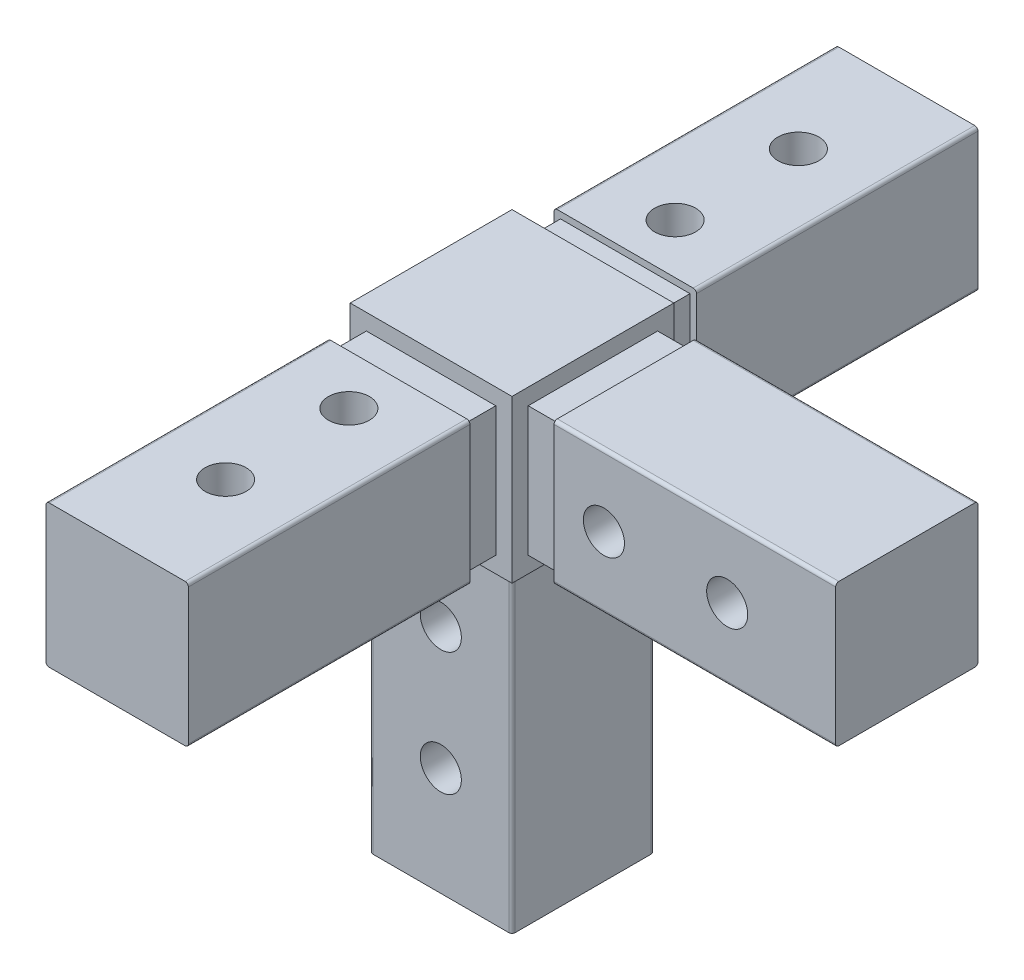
SolidWorks part; units mm, degrees
ref_plane "Front Plane" through (0, 0, 0) normal (0, 0, 1) x (1, 0, 0)
ref_plane "Top Plane" through (0, 0, 0) normal (0, 1, 0) x (1, 0, 0)
ref_plane "Right Plane" through (0, 0, 0) normal (1, 0, 0) x (0, 0, -1)
ref_plane "Plane1" through (0, -10, 0) normal (0, -1, 0) x (1, 0, 0)
sketch "Sketch1" plane through (0, -10, 0) normal (0, -1, 0) x (1, 0, 0)
  line L0 (-10, -17.5) -> (12.5, -17.5)
  line L1 (12.5, -17.5) -> (12.5, 12.5)
  line L2 (12.5, 12.5) -> (-10, 12.5)
  line L3 (-10, 12.5) -> (-10, -17.5)
extrude "Boss-Extrude1" add sketch "Sketch1" against normal blind 20
sketch "Sketch2" plane through (12.5, 0, 0) normal (1, 0, 0) x (0, 0, -1)
  line L0 (12.5, 10) -> (12.5, -10)
  line L1 (12.5, -10) -> (17.5, -10)
  line L2 (17.5, -10) -> (17.5, 10)
  line L3 (17.5, 10) -> (12.5, 10)
extrude "Cut-Extrude1" cut sketch "Sketch2" against normal blind 2.5
sketch "Sketch3" plane through (12.5, 0, 0) normal (1, 0, 0) x (0, 0, -1)
  line L0 (-10, 10) -> (10, 10)
  line L1 (10, 10) -> (10, -10)
  line L2 (10, -10) -> (-10, -10)
  line L3 (-10, -10) -> (-10, 10)
extrude "Boss-Extrude2" add sketch "Sketch3" along normal blind 5
sketch "Sketch4" plane through (17.5, 0, 0) normal (1, 0, 0) x (0, 0, -1)
  line L0 (11, -10) -> (-10, -10)
  line L1 (-10, -10) -> (-10, 11)
  line L2 (-10, 11) -> (11, 11)
  line L3 (11, 11) -> (11, -10)
extrude "Boss-Extrude3" add sketch "Sketch4" along normal blind 43.5
ref_plane "Plane2" through (0, 0, -17.5) normal (0, 0, 1) x (1, 0, 0)
sketch "Sketch5" plane through (0, 0, -17.5) normal (0, 0, 1) x (1, 0, 0)
  line L0 (-11, 11) -> (-11, -11)
  line L1 (-11, -11) -> (11, -11)
  line L2 (11, -11) -> (11, 11)
  line L3 (11, 11) -> (-11, 11)
extrude "Boss-Extrude4" add sketch "Sketch5" against normal blind 43.5
sketch "Sketch6" plane through (0, -10, 0) normal (0, -1, 0) x (1, 0, 0)
  line L0 (-10, 12.5) -> (12.5, 12.5)
  line L1 (12.5, 12.5) -> (12.5, -12.5)
  line L2 (12.5, -12.5) -> (-10, -12.5)
  line L3 (-10, -12.5) -> (-10, 12.5)
extrude "Boss-Extrude5" add sketch "Sketch6" along normal blind 2.5
sketch "Sketch7" plane through (-10, 0, 0) normal (-1, 0, 0) x (0, 0, 1)
  line L0 (12.5, 10) -> (12.5, -12.5)
  line L1 (12.5, -12.5) -> (-12.5, -12.5)
  line L2 (-12.5, -12.5) -> (-12.5, 10)
  line L3 (-12.5, 10) -> (12.5, 10)
extrude "Boss-Extrude6" add sketch "Sketch7" along normal blind 2.5
sketch "Sketch8" plane through (0, 10, 0) normal (0, 1, 0) x (-1, 0, 0)
  line L0 (12.5, -12.5) -> (-12.5, -12.5)
  line L1 (-12.5, -12.5) -> (-12.5, 12.5)
  line L2 (-12.5, 12.5) -> (12.5, 12.5)
  line L3 (12.5, 12.5) -> (12.5, -12.5)
extrude "Boss-Extrude7" add sketch "Sketch8" along normal blind 2.5
sketch "Sketch9" plane through (0, 0, 12.5) normal (0, 0, 1) x (1, 0, 0)
  line L0 (-10, 10) -> (10, 10)
  line L1 (10, 10) -> (10, -10)
  line L2 (10, -10) -> (-10, -10)
  line L3 (-10, -10) -> (-10, 10)
extrude "Boss-Extrude8" add sketch "Sketch9" along normal blind 48.5
sketch "Sketch10" plane through (0, 10, 0) normal (0, 1, 0) x (-1, 0, 0)
  line L0 (-10, 61) -> (10, 61)
  line L1 (10, 61) -> (10, 17.5)
  line L2 (10, 17.5) -> (-10, 17.5)
  line L3 (-10, 17.5) -> (-10, 61)
extrude "Boss-Extrude9" add sketch "Sketch10" along normal blind 1
sketch "Sketch11" plane through (10, 0, 0) normal (1, 0, 0) x (0, 0, -1)
  line L0 (-61, -10) -> (-61, 11)
  line L1 (-61, 11) -> (-17.5, 11)
  line L2 (-17.5, 11) -> (-17.5, -10)
  line L3 (-17.5, -10) -> (-61, -10)
extrude "Boss-Extrude10" add sketch "Sketch11" along normal blind 1
sketch "Sketch12" plane through (0, -10, 0) normal (0, -1, 0) x (1, 0, 0)
  line L0 (-10, 61) -> (11, 61)
  line L1 (11, 61) -> (11, 17.5)
  line L2 (11, 17.5) -> (-10, 17.5)
  line L3 (-10, 17.5) -> (-10, 61)
extrude "Boss-Extrude11" add sketch "Sketch12" along normal blind 1
sketch "Sketch13" plane through (-10, 0, 0) normal (-1, 0, 0) x (0, 0, 1)
  line L0 (61, 11) -> (61, -11)
  line L1 (61, -11) -> (17.5, -11)
  line L2 (17.5, -11) -> (17.5, 11)
  line L3 (17.5, 11) -> (61, 11)
extrude "Boss-Extrude12" add sketch "Sketch13" along normal blind 1
sketch "Sketch14" plane through (0, -10, 0) normal (0, -1, 0) x (1, 0, 0)
  line L0 (61, 10) -> (61, -11)
  line L1 (61, -11) -> (17.5, -11)
  line L2 (17.5, -11) -> (17.5, 10)
  line L3 (17.5, 10) -> (61, 10)
extrude "Boss-Extrude13" add sketch "Sketch14" along normal blind 1
sketch "Sketch15" plane through (0, 0, 10) normal (0, 0, 1) x (1, 0, 0)
  line L0 (61, 11) -> (61, -11)
  line L1 (61, -11) -> (17.5, -11)
  line L2 (17.5, -11) -> (17.5, 11)
  line L3 (17.5, 11) -> (61, 11)
extrude "Boss-Extrude14" add sketch "Sketch15" along normal blind 1
sketch "Sketch16" plane through (0, -12.5, 0) normal (0, -1, 0) x (1, 0, 0)
  line L0 (-11, 11) -> (11, 11)
  line L1 (11, 11) -> (11, -11)
  line L2 (11, -11) -> (-11, -11)
  line L3 (-11, -11) -> (-11, 11)
extrude "Boss-Extrude15" add sketch "Sketch16" along normal blind 48.5
fillet "Fillet1" radius 0.5 16 edges at (39.25, -11, 11) (-11, -36.75, -11) (11, -36.75, 11) (11, -11, 39.25) (11, 11, 39.25) (39.25, 11, -11) (-11, 11, 39.25) (-11, -36.75, 11) (11, -36.75, -11) (-11, 11, -39.25) (39.25, 11, 11) (11, 11, -39.25) (39.25, -11, -11) (11, -11, -39.25) (-11, -11, 39.25) (-11, -11, -39.25)
sketch "Sketch17" plane through (0, -11, 0) normal (0, -1, 0) x (1, 0, 0)
  line L0 (0, -61) -> (0, -12.5) construction
  line L1 (-10.5, -61) -> (10.5, -61) construction
  line L2 (-12.5, -12.5) -> (12.5, -12.5) construction
  line L3 (-10, -12.5) -> (10, -12.5) construction
  line L4 (0, 61) -> (0, 12.5) construction
  line L5 (10.5, 61) -> (-10.5, 61) construction
  line L6 (-10, 12.5) -> (10, 12.5) construction
  circle A0 centre (0, -25.2) radius 3.175
  circle A1 centre (0, -44.25) radius 3.175
  circle A2 centre (0, 25.2) radius 3.175
  circle A3 centre (0, 44.25) radius 3.175
  dimension "D3" = 6.35
  dimension "D4" = 6.35
  dimension "D7" = 6.35
  dimension "D8" = 6.35
  dimension "D1" = 12.7
  dimension "D2" = 31.75
  dimension "D5" = 12.7
  dimension "D6" = 31.75
extrude "Cut-Extrude2" cut sketch "Sketch17" against normal up to surface (22 mm away)
sketch "Sketch18" plane through (0, 0, 11) normal (0, 0, 1) x (1, 0, 0)
  line L0 (12.5, 0) -> (61, 0) construction
  line L1 (12.5, 10) -> (12.5, -10) construction
  line L2 (61, -10.5) -> (61, 10.5) construction
  line L3 (0, -12.5) -> (0, -61) construction
  line L4 (10.5, -12.5) -> (-10.5, -12.5) construction
  line L5 (10.5, -61) -> (-10.5, -61) construction
  line L6 (12.5, -12.5) -> (-12.5, -12.5) construction
  line L7 (12.5, 12.5) -> (12.5, -12.5) construction
  circle A0 centre (0, -25.2) radius 3.175
  circle A1 centre (0, -44.25) radius 3.175
  circle A2 centre (25.2, 0) radius 3.175
  circle A3 centre (44.25, 0) radius 3.175
  dimension "D3" = 6.35
  dimension "D4" = 6.35
  dimension "D7" = 6.35
  dimension "D8" = 6.35
  dimension "D1" = 12.7
  dimension "D2" = 31.75
  dimension "D5" = 12.7
  dimension "D6" = 31.75
extrude "Cut-Extrude3" cut sketch "Sketch18" against normal up to surface (22 mm away)
